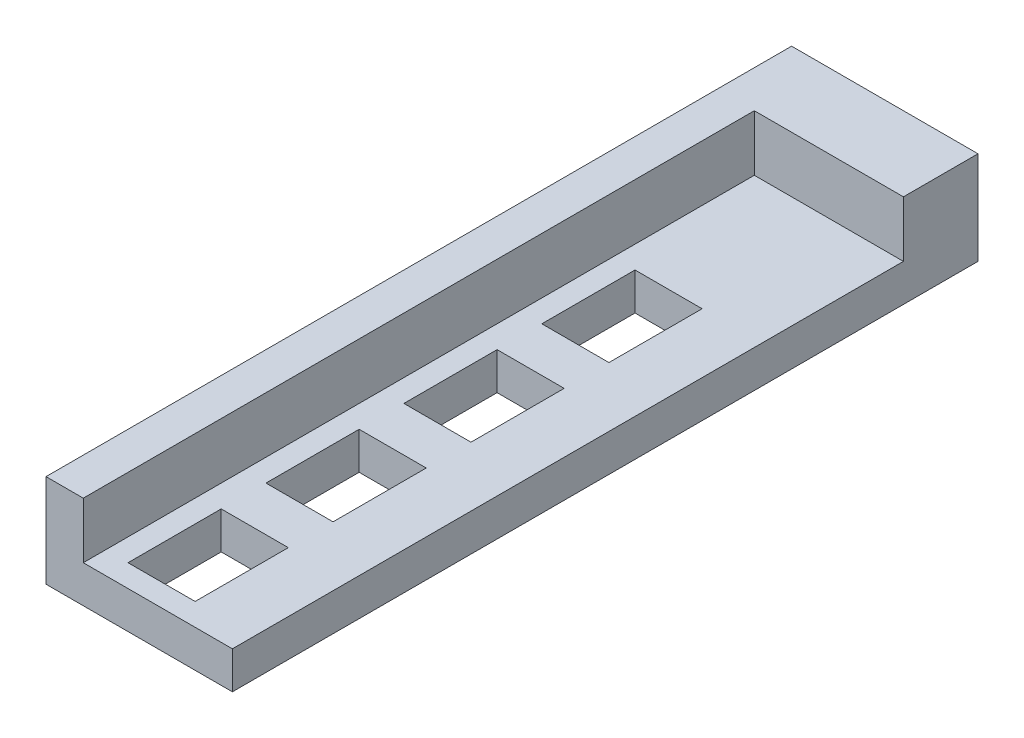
SolidWorks part; units mm, degrees
ref_plane "Front Plane" through (0, 0, 0) normal (0, 0, 1) x (1, 0, 0)
ref_plane "Top Plane" through (0, 0, 0) normal (0, 1, 0) x (1, 0, 0)
ref_plane "Right Plane" through (0, 0, 0) normal (1, 0, 0) x (0, 0, -1)
sketch "Sketch1" plane through (0, 0, 0) normal (0, 0, 1) x (1, 0, 0)
  line L1 (0, 0) -> (50, 0)
  line L2 (0, 0) -> (0, 25)
  line L3 (0, 25) -> (50, 25)
  line L4 (50, 0) -> (50, 25)
  dimension "D1" = 50
  dimension "D2" = 25
extrude "Boss-Extrude1" add sketch "Sketch1" along normal blind 200
shell "Shell1" thickness 10
sketch "Sketch2" plane through (0, 10, 0) normal (0, 1, 0) x (1, 0, 0)
  line L0 (10, -200) -> (10, -20) construction
  line L1 (16, -194) -> (34, -194)
  line L2 (16, -194) -> (16, -169)
  line L5 (16, -169) -> (34, -169)
  line L6 (34, -194) -> (34, -169)
  line L7 (10, -200) -> (50, -200) construction
  dimension "D4" = 25
  dimension "D1" = 6
  dimension "D2" = 6
  dimension "D3" = 18
extrude "Cut-Extrude1" cut sketch "Sketch2" against normal through all
pattern_linear "LPattern1" count 4 spacing 37 along (0, 0, -1) of "Cut-Extrude1"
